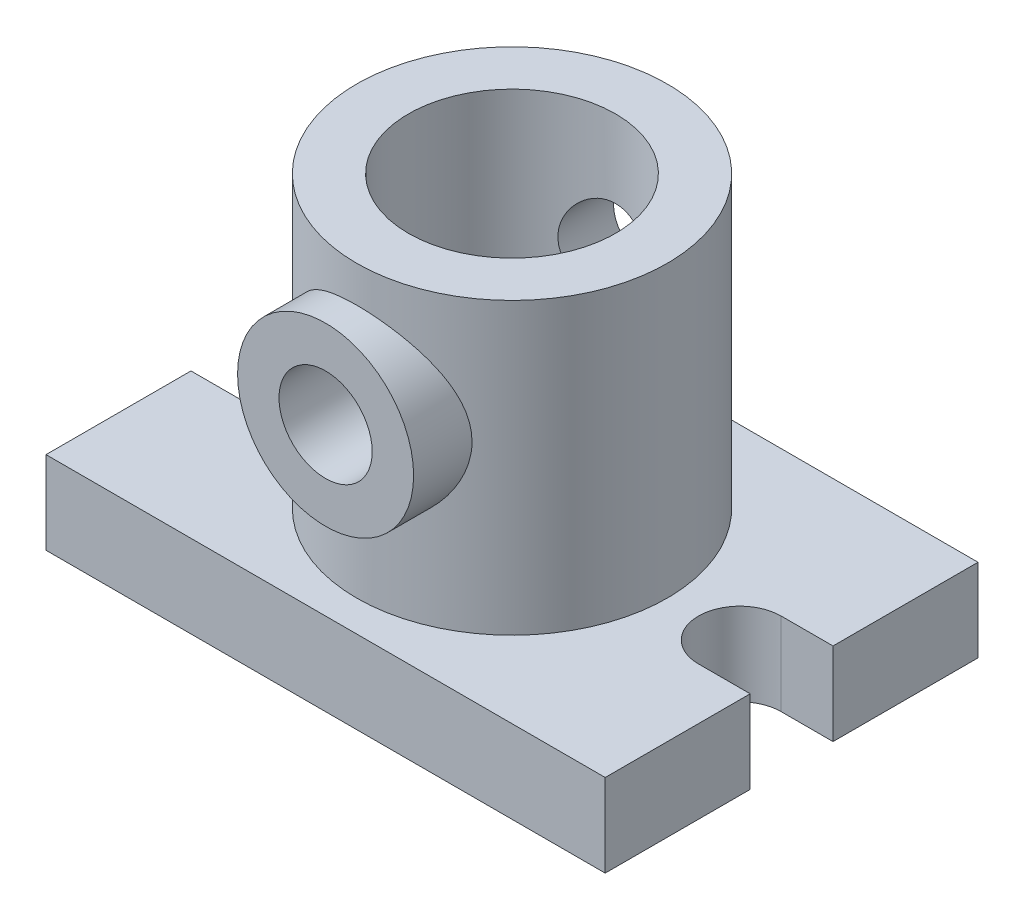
SolidWorks part; units mm, degrees
ref_plane "前视基准面" through (0, 0, 0) normal (0, 0, 1) x (1, 0, 0)
ref_plane "上视基准面" through (0, 0, 0) normal (0, 1, 0) x (1, 0, 0)
ref_plane "右视基准面" through (0, 0, 0) normal (1, 0, 0) x (0, 0, -1)
sketch "草图1" plane through (0, 0, 0) normal (0, 1, 0) x (1, 0, 0)
  line L0 (-62.6466, 0) -> (75.1759, 0) construction
  line L1 (0, 79.513) -> (0, -61.2009) construction
  line L2 (-27, 4) -> (-27, 18)
  line L3 (-27, 18) -> (27, 18)
  line L4 (-22, 17.8302) -> (-22, -13.6537) construction
  line L5 (-22, 4) -> (-27, 4)
  line L6 (27, 4) -> (27, 18)
  line L7 (22, 4) -> (27, 4)
  line L8 (22, -4) -> (27, -4)
  line L9 (27, -4) -> (27, -18)
  line L10 (-27, -18) -> (27, -18)
  line L11 (-27, -4) -> (-27, -18)
  line L12 (-22, -4) -> (-27, -4)
  circle A0 centre (0, 0) radius 4.5
  arc A1 (-22, -4) -> (-22, 4) centre (-22, 0) ccw
  arc A2 (22, -4) -> (22, 4) centre (22, 0) cw
  point P13 (0, 18)
  dimension "D1" = 9
  dimension "D2" = 8
  dimension "D3" = 27
  dimension "D4" = 22
extrude "凸台-拉伸1" add sketch "草图1" along normal blind 8
sketch "草图2" plane through (0, 0, 0) normal (0, 1, 0) x (1, 0, 0)
  circle A0 centre (0, 0) radius 15
  circle A1 centre (0, 0) radius 4.5
  dimension "D1" = 30
extrude "凸台-拉伸2" add sketch "草图2" along normal blind 36
sketch "草图3" plane through (0, 36, 0) normal (0, 1, 0) x (1, 0, 0)
  circle A0 centre (0, 0) radius 10
  dimension "D1" = 20
extrude "切除-拉伸1" cut sketch "草图3" against normal blind 23
sketch "草图4" plane through (0, 0, 18) normal (0, 0, 1) x (1, 0, 0)
  line L0 (-8.4168, 24) -> (9.6586, 24) construction
  circle A0 centre (0, 24) radius 8.5
  dimension "D2" = 17
  dimension "D1" = 24
extrude "凸台-拉伸3" add sketch "草图4" against normal up to next
sketch "草图5" plane through (0, 0, 0) normal (0, 0, 1) x (1, 0, 0)
  circle A0 centre (0, 24) radius 4.5
  dimension "D1" = 9
extrude "切除-拉伸2" cut sketch "草图5" against normal mid plane 45
